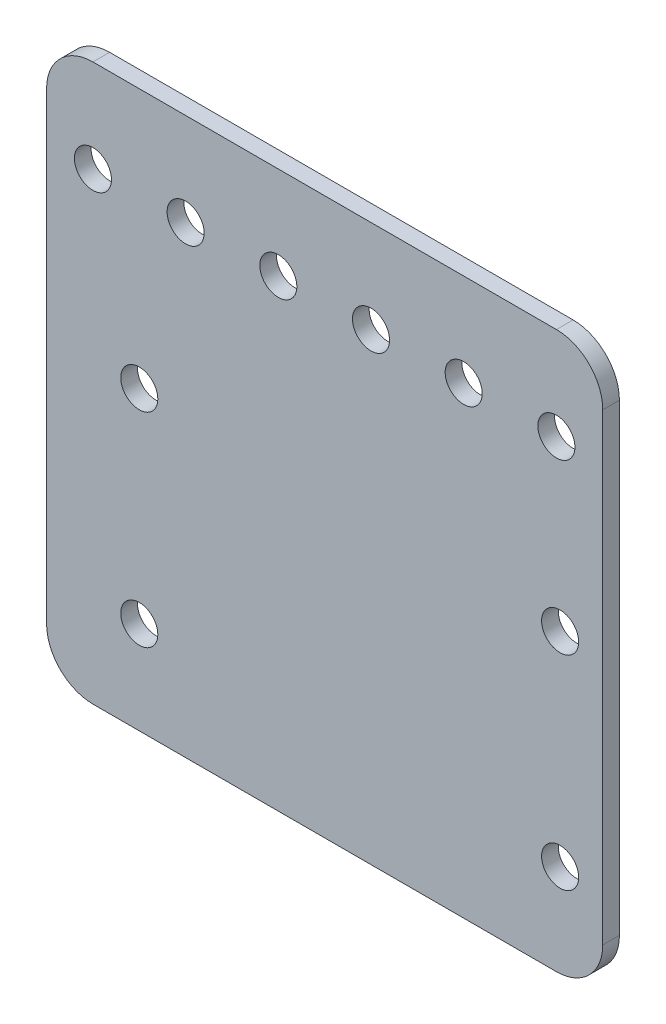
SolidWorks part; units mm, degrees
ref_plane "Front Plane" through (0, 0, 0) normal (0, 0, 1) x (1, 0, 0)
ref_plane "Top Plane" through (0, 0, 0) normal (0, 1, 0) x (1, 0, 0)
ref_plane "Right Plane" through (0, 0, 0) normal (1, 0, 0) x (0, 0, -1)
sketch "Sketch1" plane through (0, 0, 0) normal (0, 0, 1) x (1, 0, 0)
  line L1 (0, 0) -> (76.2, 0)
  line L2 (0, 0) -> (0, 76.2)
  line L3 (0, 76.2) -> (76.2, 76.2)
  line L4 (76.2, 0) -> (76.2, 76.2)
  dimension "D1" = 76.2
  dimension "D2" = 76.2
base flange "Base-Flange1" sketch "Sketch1" thickness 2.286 reverse thickness direction no parameters "D1"=2.286
hole_wizard "Hole1" positions "Sketch6" profile "Sketch7" legacy
sketch "Sketch6" plane through (0, 0, 0) normal (0, 0, 1) x (1, 0, 0)
  line L0 (76.2, 76.2) -> (0, 76.2) construction
  line L1 (0, 76.2) -> (0, 0) construction
  point P0 (6.35, 63.5)
  dimension "D1" = 12.7
  dimension "D2" = 6.35
sketch "Sketch7" plane through (6.35, 63.5, 0) normal (1, 0, 0) x (0, -1, 0)
  line L0 (0, 0) -> (0, 2.286)
  line L1 (0, 2.286) -> (2.54, 2.286)
  line L2 (2.54, 2.286) -> (2.54, 0)
  line L3 (2.54, 0) -> (0, 0)
  line L4 (0, 110) -> (0, -10) construction
  dimension "Diameter" = 5.08
  dimension "Depth" = 2.286
pattern_linear "LPattern1" count 6 spacing 12.7 along (1, 0, 0) of "Hole1"
fillet "Fillet1" radius 6.35 4 edges at (0, 0, -1.143) (0, 76.2, -1.143) (76.2, 76.2, -1.143) (76.2, 0, -1.143)
sketch "Sketch8" plane through (0, 0, 0) normal (0, 0, 1) x (1, 0, 0)
  line L0 (0, 69.85) -> (0, 6.35) construction
  line L1 (12.7, 12.7) -> (70.358, 12.7) construction
  line L2 (12.7, 12.7) -> (12.7, 40.64) construction
  line L3 (12.7, 40.64) -> (70.358, 40.64) construction
  line L4 (70.358, 12.7) -> (70.358, 40.64) construction
  line L5 (6.35, 0) -> (69.85, 0) construction
  circle A0 centre (12.7, 40.64) radius 2.54
  circle A1 centre (70.358, 40.64) radius 2.54
  circle A2 centre (70.358, 12.7) radius 2.54
  circle A3 centre (12.7, 12.7) radius 2.54
  dimension "D1" = 27.94
  dimension "D4" = 5.08
  dimension "D2" = 57.658
  dimension "D3" = 12.7
  dimension "D5" = 12.7
extrude "Cut-Extrude1" cut sketch "Sketch8" against normal blind 2.54 contours A3 | A2 | A1 | A0
sketch "Bend-Lines1" [suppressed] plane through (0, 0, 0) normal (0, 1, 0) x (1, 0, 0)
sketch "Bounding-Box1" [suppressed] plane through (0, 0, 0) normal (0, 1, 0) x (1, 0, 0)
sheet metal parameters "Sheet-Metal1" thickness 2.286 parameters "D1"=2.286
flat pattern "Flat-Pattern1"
sketch "Bend-Lines2" plane through (0, 0, 0) normal (0, 1, 0) x (1, 0, 0)
sketch3d "Bounding-Box2" [suppressed]
  line L0 (0, 0, 0) -> (-76.2, 0, 0) construction
  line L1 (0, 76.2, 0) -> (-76.2, 76.2, 0) construction
  line L2 (0, 0, 0) -> (0, 76.2, 0) construction
  line L3 (-76.2, 0, 0) -> (-76.2, 76.2, 0) construction
sheet metal parameters "Sheet-Metal2" thickness 2.286 parameters "D1"=2.286
flat pattern "Flat-Pattern1"
sketch "Bend-Lines2" plane through (0, 0, 0) normal (0, 1, 0) x (1, 0, 0)
sketch3d "Bounding-Box2" [suppressed]
  line L0 (0, 0, 0) -> (76.2, 0, 0) construction
  line L1 (0, 76.2, 0) -> (76.2, 76.2, 0) construction
  line L2 (0, 0, 0) -> (0, 76.2, 0) construction
  line L3 (76.2, 0, 0) -> (76.2, 76.2, 0) construction
sheet metal parameters "Sheet-Metal3" thickness 2.286 parameters "D1"=2.286
flat pattern "Flat-Pattern1"
sketch "Bend-Lines2" plane through (0, 0, 0) normal (0, 1, 0) x (1, 0, 0)
sketch3d "Bounding-Box2" [suppressed]
  line L0 (76.2, 0, 0) -> (76.2, 76.2, 0) construction
  line L1 (0, 0, 0) -> (0, 76.2, 0) construction
  line L2 (76.2, 0, 0) -> (0, 0, 0) construction
  line L3 (76.2, 76.2, 0) -> (0, 76.2, 0) construction
sheet metal parameters "Sheet-Metal4" thickness 2.286 parameters "D1"=2.286
flat pattern "Flat-Pattern1"
sketch "Bend-Lines2" plane through (0, 0, 0) normal (0, 1, 0) x (1, 0, 0)
sketch3d "Bounding-Box2" [suppressed]
  line L0 (76.2, 0, 0) -> (76.2, 76.2, 0) construction
  line L1 (0, 0, 0) -> (0, 76.2, 0) construction
  line L2 (76.2, 0, 0) -> (0, 0, 0) construction
  line L3 (76.2, 76.2, 0) -> (0, 76.2, 0) construction
